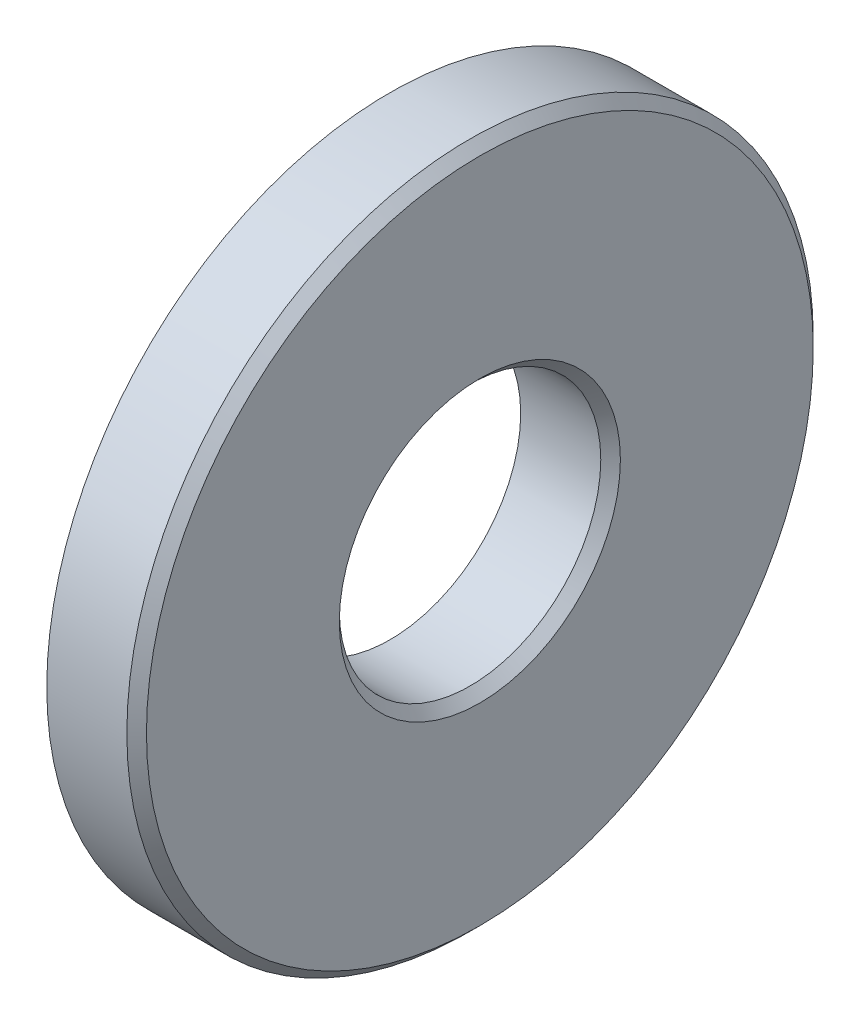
SolidWorks part; units mm, degrees
ref_plane "Front Plane" through (0, 0, 0) normal (0, 0, 1) x (1, 0, 0)
ref_plane "Top Plane" through (0, 0, 0) normal (0, 1, 0) x (1, 0, 0)
ref_plane "Right Plane" through (0, 0, 0) normal (1, 0, 0) x (0, 0, -1)
sketch "Esquisse1" plane through (0, 0, 0) normal (0, 0, 1) x (1, 0, 0)
  line L0 (0, 10.5) -> (0, 4)
  line L1 (0, 4) -> (2.45, 4)
  line L2 (2.45, 4) -> (2.75, 4.3)
  line L3 (2.75, 4.3) -> (2.75, 10.2)
  line L4 (2.75, 10.2) -> (2.45, 10.5)
  line L5 (2.45, 10.5) -> (0, 10.5)
  line L6 (0, 0) -> (2.75, 0) construction
revolve "Révolution1" add sketch "Esquisse1" angle 360 about L6
